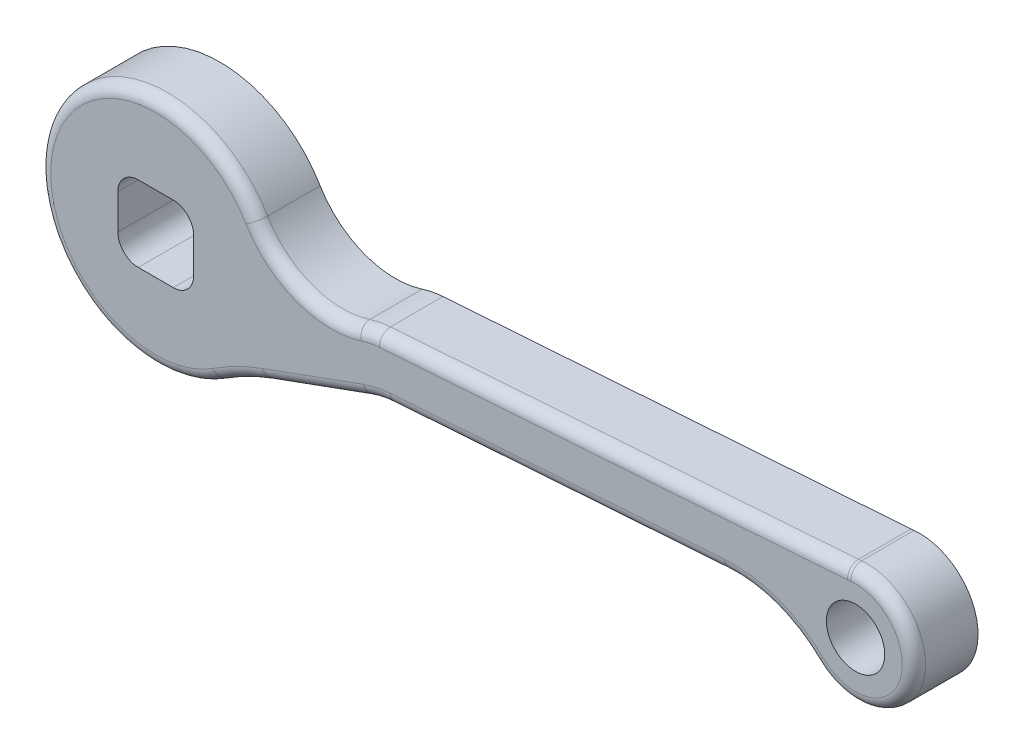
SolidWorks part; units mm, degrees
ref_plane "Plan de face" through (0, 0, 0) normal (0, 0, 1) x (1, 0, 0)
ref_plane "Plan de dessus" through (0, 0, 0) normal (0, 1, 0) x (1, 0, 0)
ref_plane "Plan de droite" through (0, 0, 0) normal (1, 0, 0) x (0, 0, -1)
sketch "Esquisse1" plane through (0, 0, 0) normal (0, 0, 1) x (1, 0, 0)
  line L0 (0, 0) -> (120, 0) construction
  line L1 (97.7042, -1.5699) -> (40.3433, -5.581)
  line L2 (36.2594, -6.449) -> (19, -12.7309)
  line L4 (118.5004, 9.9087) -> (38.2438, 4.2966)
  line L6 (-3, 6.5) -> (3, 6.5)
  line L7 (-6.5, 3) -> (-6.5, -3)
  line L8 (-3, -6.5) -> (3, -6.5)
  line L9 (6.5, 3) -> (6.5, -3)
  arc A0 (17.1913, 10.2205) -> (10.8936, -16.7729) centre (0, 0) ccw
  arc A1 (113.0331, -7.1737) -> (119.0351, 9.9533) centre (120, 0) ccw
  arc A2 (34.6874, 3.6096) -> (17.1913, 10.2205) centre (30.0848, 17.886) cw
  arc A3 (38.2438, 4.2966) -> (34.6874, 3.6096) centre (39.2901, -10.6668) ccw
  arc A4 (40.3433, -5.581) -> (36.2594, -6.449) centre (41.3897, -20.5444) ccw
  arc A5 (19, -12.7309) -> (10.8936, -16.7729) centre (32.6808, -50.3186) ccw
  arc A6 (119.0351, 9.9533) -> (118.5004, 9.9087) centre (117.1052, 29.86) cw
  arc A7 (113.0331, -7.1737) -> (97.7042, -1.5699) centre (99.0993, -21.5212) ccw
  circle A8 centre (120, 0) radius 5
  arc A9 (-3, 6.5) -> (-6.5, 3) centre (-3, 3) ccw
  arc A10 (6.5, 3) -> (3, 6.5) centre (3, 3) ccw
  arc A11 (3, -6.5) -> (6.5, -3) centre (3, -3) ccw
  arc A12 (-6.5, -3) -> (-3, -6.5) centre (-3, -3) ccw
  point P28 (-6.5, 6.5)
  point P35 (-6.5, -6.5)
  dimension "D1" = 40
  dimension "D2" = 20
  dimension "D3" = 120
  dimension "D5" = 15
  dimension "D6" = 40
  dimension "D7" = 20
  dimension "D8" = 10
  dimension "D13" = 3.5
  dimension "D18" = 36.2594
  dimension "D9" = 13
  dimension "D10" = 13
  dimension "D11" = 6.5
  dimension "D12" = 6.5
  dimension "D14" = 34.6874
  dimension "D15" = 4
  dimension "D16" = 81.7562
  dimension "D17" = 19
  dimension "D4" = 10
extrude "Extrusion1" add sketch "Esquisse1" along normal blind 11
fillet "Congé6" radius 2 11 edges at (24.7828, 3.8542, 11) (36.4448, 4.0608, 11) (78.3721, 7.1027, 11) (118.7679, 9.9292, 11) (129.4373, -3.3072, 11) (105.9663, -2.737, 11) (69.0238, -3.5754, 11) (38.271, -5.8722, 11) (27.6297, -9.59, 11) (14.832, -14.5217, 11) (-19.4769, 4.5441, 11)
